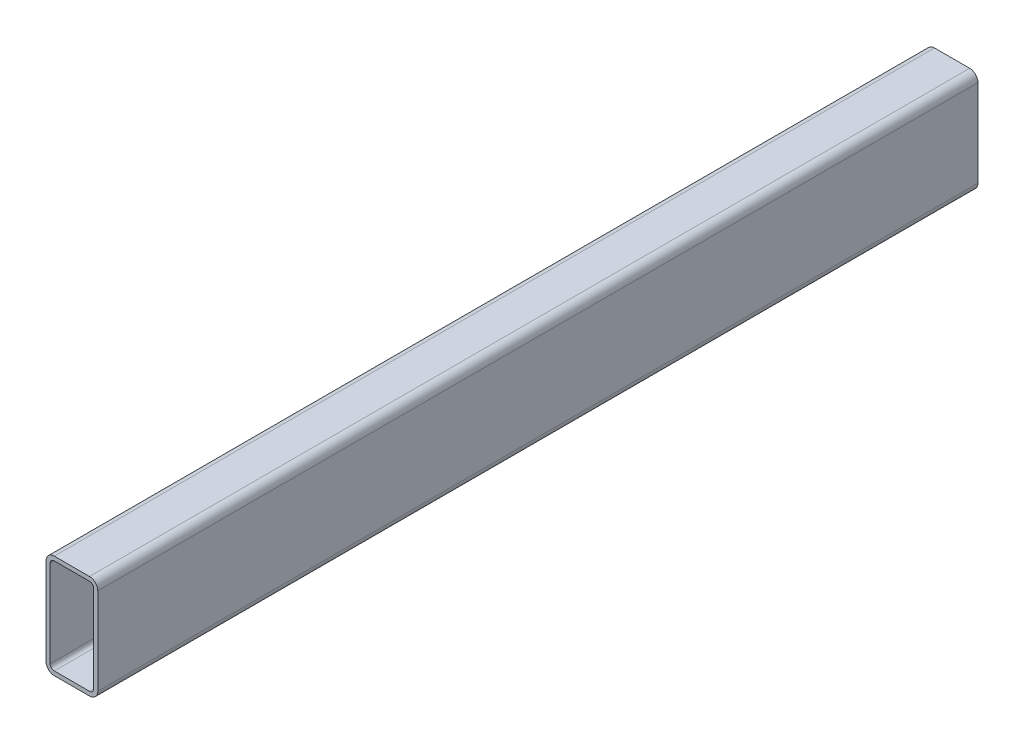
SolidWorks part; units mm, degrees
ref_plane "Face" through (0, 0, 0) normal (0, 0, 1) x (1, 0, 0)
ref_plane "Dessus" through (0, 0, 0) normal (0, 1, 0) x (1, 0, 0)
ref_plane "Droite" through (0, 0, 0) normal (1, 0, 0) x (0, 0, -1)
mirrored part "Rectangular_Tube_ISO_Rendre symétrique"
other "<Rectangular_Tube_ISO>-<BaseTubeR>"
